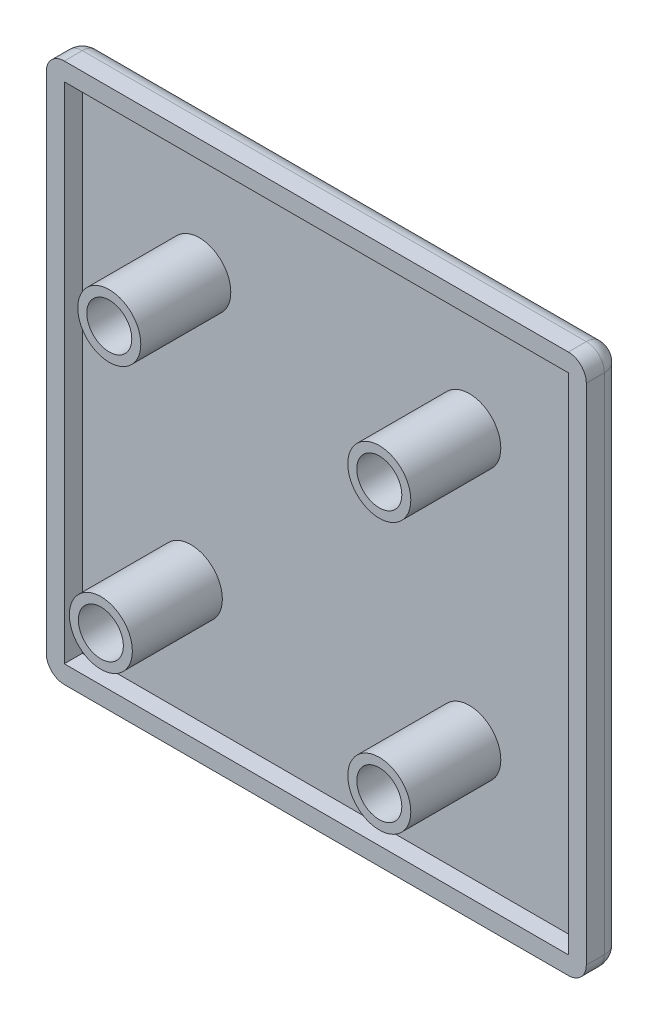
SolidWorks part; units mm, degrees
ref_plane "前视基准面" through (0, 0, 0) normal (0, 0, 1) x (1, 0, 0)
ref_plane "上视基准面" through (0, 0, 0) normal (0, 1, 0) x (1, 0, 0)
ref_plane "右视基准面" through (0, 0, 0) normal (1, 0, 0) x (0, 0, -1)
sketch "草图1" plane through (0, 0, 0) normal (0, 0, 1) x (1, 0, 0)
  line L1 (-30, 30) -> (30, 30)
  line L2 (-30, 30) -> (-30, -30)
  line L3 (-30, -30) -> (30, -30)
  line L4 (30, 30) -> (30, -30)
  dimension "D1" = 60
  dimension "D2" = 60
  dimension "D3" = 30
extrude "凸台-拉伸1" add sketch "草图1" along normal mid plane 4
shell "抽壳1" thickness 2
fillet "圆角2" radius 2 8 edges at (-30, 30, 0) (30, -30, 0) (-30, -30, 0) (-30, 0, -2) (0, -30, -2) (30, 0, -2) (0, 30, -2) (30, 30, 0)
sketch "草图2" plane through (0, 0, 0) normal (0, 0, 1) x (1, 0, 0)
  line L0 (-30, 28) -> (-30, -28) construction
  line L1 (28, 30) -> (-28, 30) construction
  line L2 (30, -28) -> (30, 28) construction
  circle A0 centre (-15, 15) radius 3.5
  circle A1 centre (15, 15) radius 3.5
  circle A2 centre (15, -15) radius 3.5
  circle A3 centre (-15.938, -15) radius 3.5
  circle A4 centre (-15, 15) radius 2.5
  circle A5 centre (15, 15) radius 2.5
  circle A6 centre (-15.938, -15) radius 2.5
  circle A7 centre (15, -15) radius 2.5
  dimension "D1" = 15
  dimension "D2" = 15
  dimension "D3" = 7
  dimension "D4" = 7
  dimension "D5" = 7
  dimension "D6" = 7
  dimension "D7" = 30
  dimension "D8" = 30
  dimension "D9" = 15
  dimension "D10" = 15
  dimension "D11" = 15
extrude "凸台-拉伸2" add sketch "草图2" along normal blind 10
